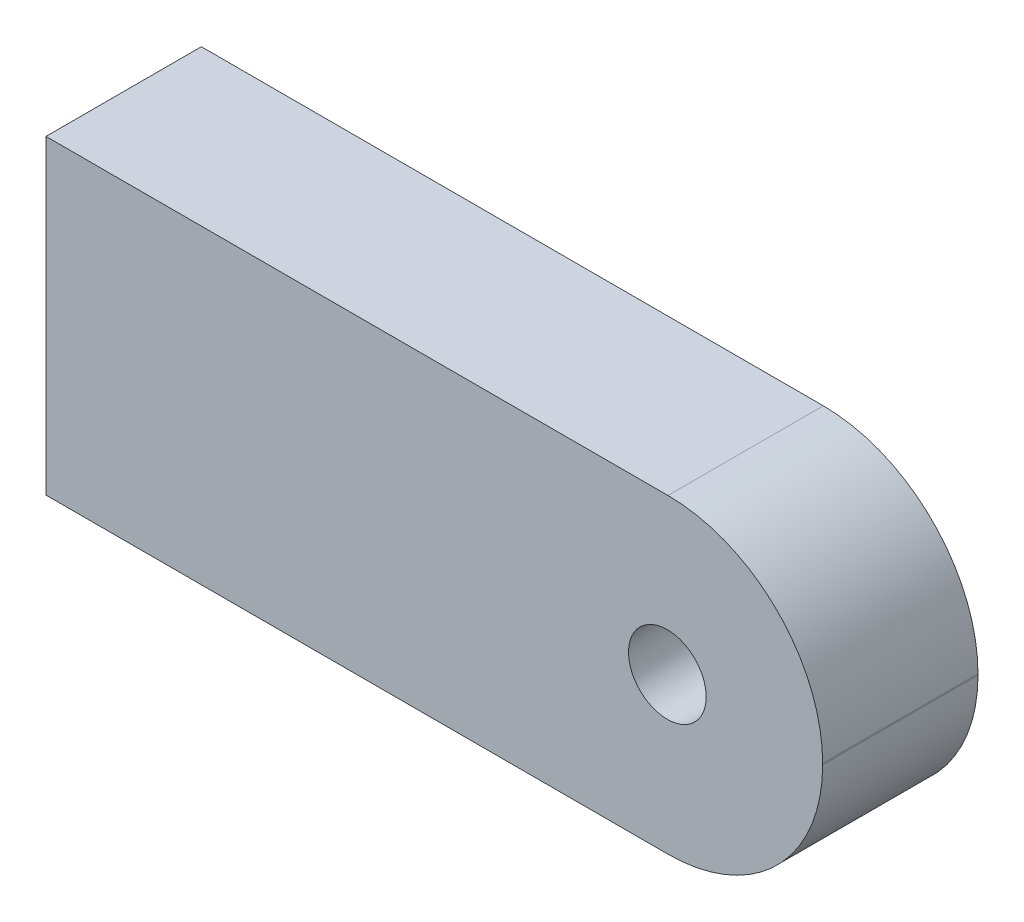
SolidWorks part; units mm, degrees
ref_plane "Front Plane" through (0, 0, 0) normal (0, 0, 1) x (1, 0, 0)
ref_plane "Top Plane" through (0, 0, 0) normal (0, 1, 0) x (1, 0, 0)
ref_plane "Right Plane" through (0, 0, 0) normal (1, 0, 0) x (0, 0, -1)
sketch "Sketch1" plane through (0, 0, 0) normal (0, 0, 1) x (1, 0, 0)
  line L1 (-25.4, 6.35) -> (0.0254, 6.35)
  line L2 (-25.4, 6.35) -> (-25.4, -6.35)
  line L3 (-25.4, -6.35) -> (0.0254, -6.35)
  line L4 (6.35, 0.0254) -> (6.35, -0.0254)
  circle A0 centre (0, 0) radius 1.5875
  arc A1 (0.0254, -6.35) -> (6.35, -0.0254) centre (0.0254, -0.0254) ccw
  arc A2 (0.0254, 6.35) -> (6.35, 0.0254) centre (0.0254, 0.0254) cw
  point P9 (6.35, -6.35)
  point P12 (6.35, 6.35)
  dimension "D1" = 6.35
  dimension "D5" = 6.3246
  dimension "D2" = 12.7
  dimension "D3" = 6.35
  dimension "D4" = 31.75
extrude "Boss-Extrude1" add sketch "Sketch1" along normal blind 6.35
